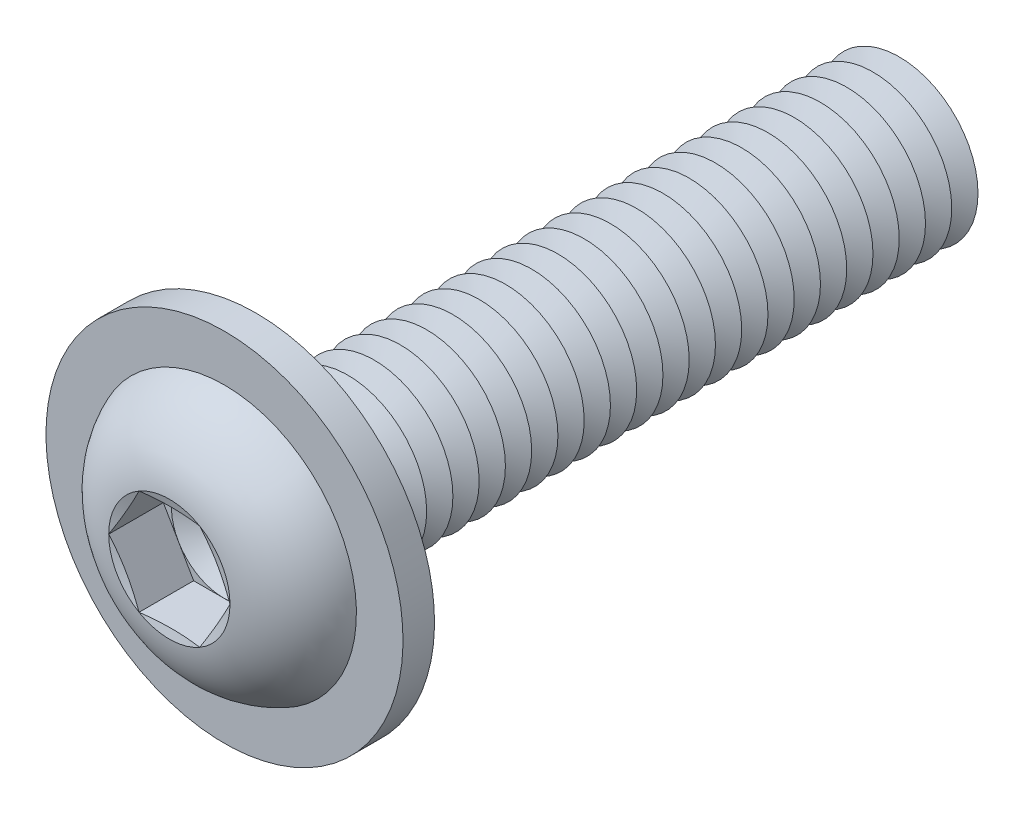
SolidWorks part; units mm, degrees
ref_plane "Front Plane" through (0, 0, 0) normal (0, 0, 1) x (1, 0, 0)
ref_plane "Top Plane" through (0, 0, 0) normal (0, 1, 0) x (1, 0, 0)
ref_plane "Right Plane" through (0, 0, 0) normal (1, 0, 0) x (0, 0, -1)
sketch "Sketch1" plane through (0, 0, 0) normal (1, 0, 0) x (0, 0, -1)
  line L0 (0, 3) -> (0, 5.25)
  line L3 (0, 3) -> (25, 3)
  line L4 (25, 3) -> (25, 0)
  line L5 (25, 0) -> (-3.3, 0) construction
  line L6 (-3.3, 0) -> (25, 0)
  line L7 (-3.3, 2.3094) -> (-3.3, 1.1547) construction
  line L8 (-3.3, 1.1547) -> (-3.3, 0)
  line L9 (-3.3, 2.3094) -> (-2.9906, 1.1547)
  line L10 (-2.9906, 1.1547) -> (-3.3, 1.1547)
  line L11 (25, 0) -> (22.7481, 0) construction
  line L12 (0, 5.25) -> (-3.3, 5.25) construction
  arc A1 (0, 5.25) -> (-3.3, 2.3094) centre (0, 1.928) ccw
  point P8 (25, 1.5)
  dimension "D1" = 10.5
  dimension "D2" = 6
  dimension "D3" = 3.3
  dimension "D4" = 4.6188
  dimension "D5" = 25
  dimension "D6" = 15
revolve "Revolve1" add sketch "Sketch1" angle 360 about L5
fillet "Fillet1" radius 0.5 1 edges at (-3, 0, 0)
sketch "Sketch2" plane through (0, 0, 0) normal (1, 0, 0) x (0, 0, -1)
  line L0 (24.5, 3) -> (25.5, 3)
  line L1 (25, 3) -> (0.5, 3) construction
  line L2 (25.5, 3) -> (25, 2.134)
  line L3 (25, -3) -> (25, 3) construction
  line L4 (25, 2.134) -> (24.5, 3)
  dimension "D1" = 1
revolve "Cut-Revolve1" cut sketch "Sketch2" angle 360 about axis through (0, 0, -25) along (0, 0, -1)
pattern_linear "LPattern1" count 25 spacing 1 along (0, 0, 1) of "Cut-Revolve1"
sketch "Sketch3" plane through (0, 0, 3.3) normal (0, 0, 1) x (1, 0, 0)
  line L7 (1.1547, 2) -> (-1.1547, 2)
  line L8 (-1.1547, 2) -> (-2.3094, 0)
  line L9 (-2.3094, 0) -> (-1.1547, -2)
  line L10 (-1.1547, -2) -> (1.1547, -2)
  line L11 (1.1547, -2) -> (2.3094, 0)
  line L12 (2.3094, 0) -> (1.1547, 2)
  circle A0 centre (0, 0) radius 2 construction
  circle A3 centre (0, 0) radius 2.3094 construction
extrude "Cut-Extrude1" cut sketch "Sketch3" against normal blind 2.08
sketch "Sketch4" plane through (0, 0, 1.22) normal (0, 0, 1) x (1, 0, 0)
  line L1 (1.1547, 2) -> (-1.1547, 2) construction
  circle A0 centre (0, 0) radius 2
extrude "Cut-Extrude2" cut sketch "Sketch4" against normal through all draft 60
sketch "Sketch5" plane through (0, 0, 0) normal (0, 0, -1) x (-1, 0, 0)
  circle A0 centre (0, 0) radius 6.8
  circle A1 centre (0, 0) radius 3.5
  circle A2 centre (0, 0) radius 3.5 construction
  dimension "D1" = 13.6
extrude "Boss-Extrude1" add sketch "Sketch5" against normal blind 1.2
